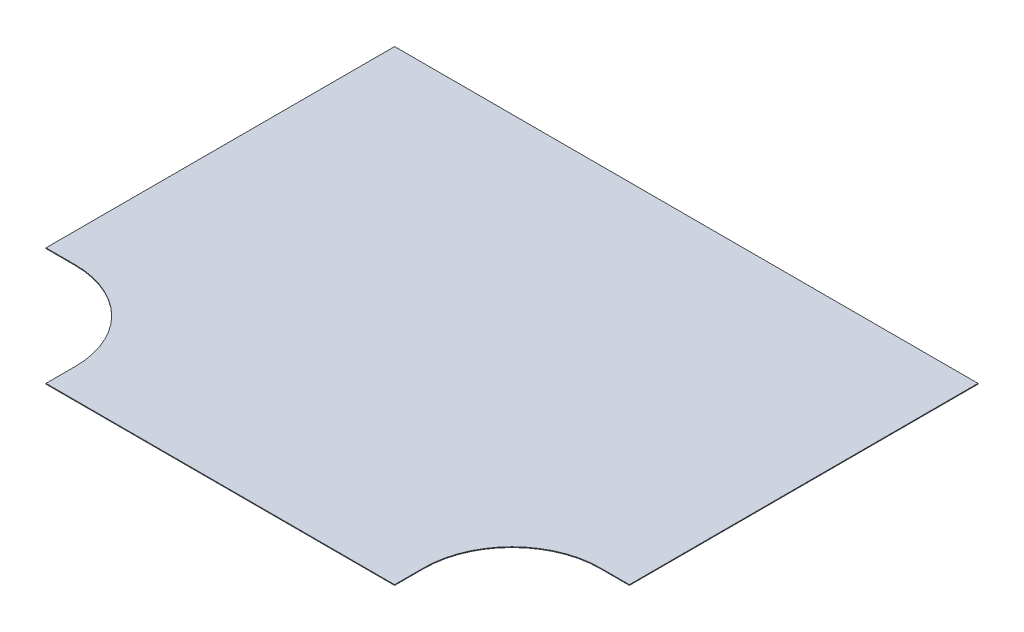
SolidWorks part; units mm, degrees
ref_plane "Front Plane" through (0, 0, 0) normal (0, 0, 1) x (1, 0, 0)
ref_plane "Top Plane" through (0, 0, 0) normal (0, 1, 0) x (1, 0, 0)
ref_plane "Right Plane" through (0, 0, 0) normal (1, 0, 0) x (0, 0, -1)
sketch "Sketch1" plane through (0, 0, 0) normal (0, 1, 0) x (1, 0, 0)
  line L0 (0, 0) -> (0, 597.572)
  line L1 (0, 597.572) -> (1000, 597.572)
  line L2 (1000, 597.572) -> (1000, 0)
  line L3 (201.214, -201.214) -> (798.786, -201.214)
  line L4 (1000, 0) -> (950, 0)
  line L5 (0, 0) -> (50, 0)
  line L6 (798.786, -201.214) -> (798.786, -151.214)
  line L7 (201.214, -201.214) -> (201.214, -151.214)
  line L8 (500, 597.572) -> (500, -201.214) construction
  arc A0 (950, 0) -> (798.786, -151.214) centre (950, -151.214) ccw
  arc A1 (50, 0) -> (201.214, -151.214) centre (50, -151.214) cw
  dimension "D1" = 597.572
  dimension "D2" = 50
  dimension "D3" = 1000
sheet metal parameters "Sheet-Metal1" thickness 1.2141 parameters "D1"=1.27
base flange "Base-Flange1" sketch "Sketch1" thickness 1.2141 reverse thickness direction yes parameters "D1"=1.27
flat pattern "Flat-Pattern1"
sketch "Bend-Lines1" plane through (0, 0, 0) normal (0, 1, 0) x (-1, 0, 0)
